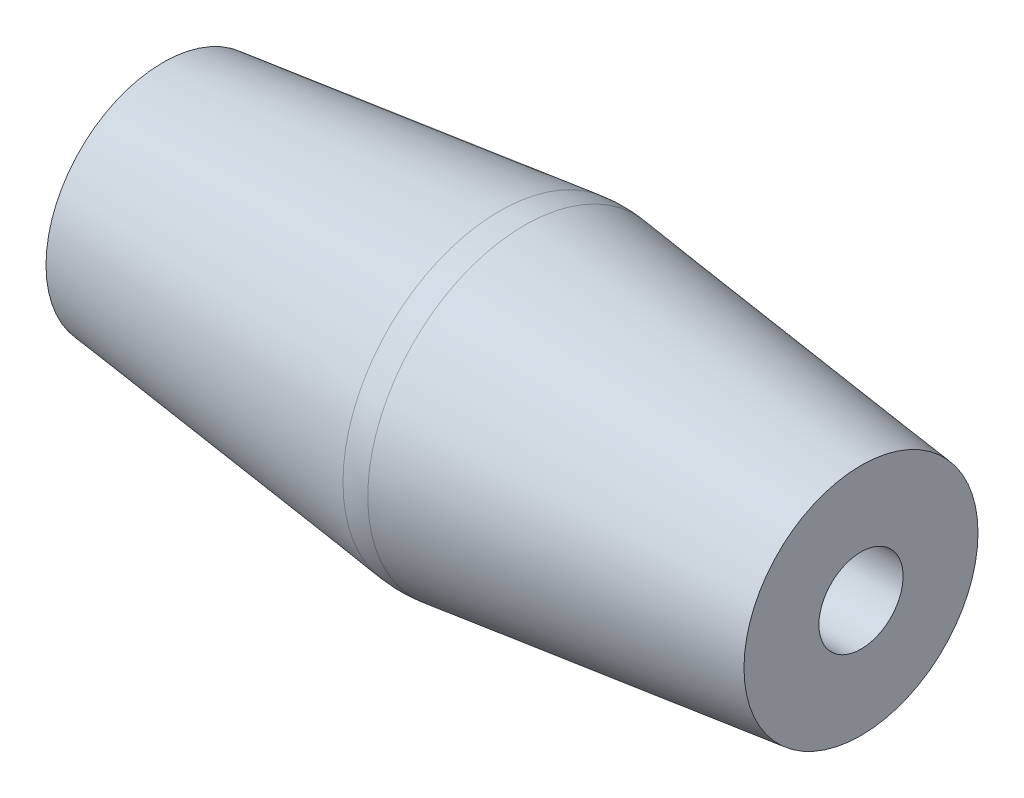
SolidWorks part; units mm, degrees
other "<Roller>-<Imported1>"
ref_plane "Front Plane" through (0, 0, 0) normal (0, 0, 1) x (1, 0, 0)
ref_plane "Top Plane" through (0, 0, 0) normal (0, 1, 0) x (1, 0, 0)
ref_plane "Right Plane" through (0, 0, 0) normal (1, 0, 0) x (0, 0, -1)
mirrored part "Roller_Mirrored"
